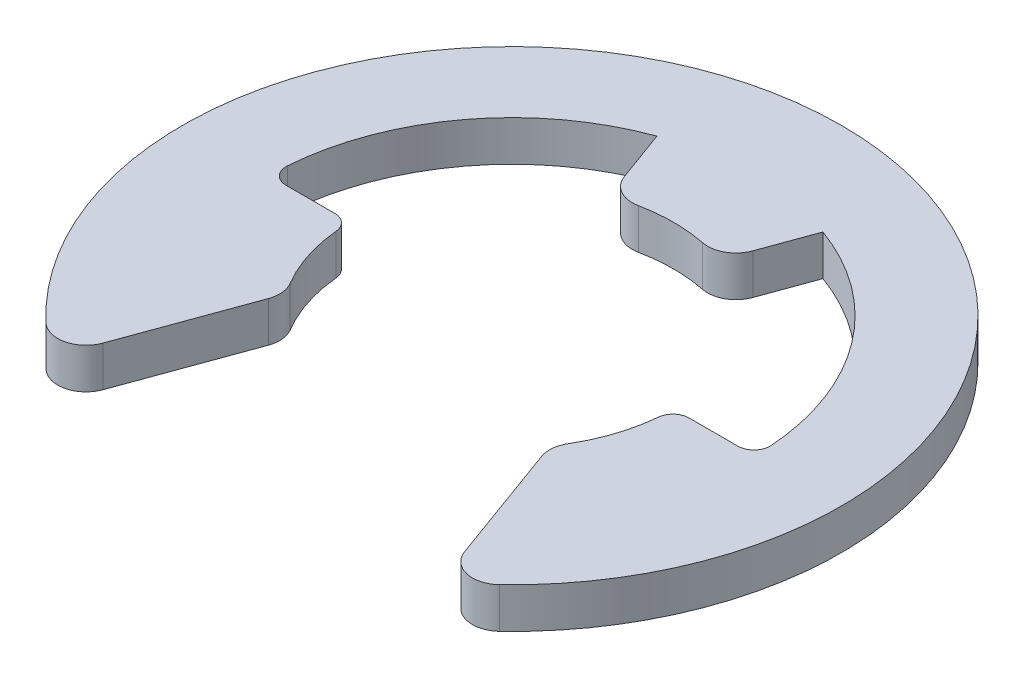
SolidWorks part; units mm, degrees
ref_plane "Front Plane" through (0, 0, 0) normal (0, 0, 1) x (1, 0, 0)
ref_plane "Top Plane" through (0, 0, 0) normal (0, 1, 0) x (1, 0, 0)
ref_plane "Right Plane" through (0, 0, 0) normal (1, 0, 0) x (0, 0, -1)
sketch "Sketch2" plane through (0, 0, 0) normal (0, 1, 0) x (1, 0, 0)
  line L0 (-4.8108, -6.5787) -> (-3.26, -2.3178)
  line L2 (3.26, -2.3178) -> (4.8108, -6.5787)
  line L4 (-4, 0) -> (-6, 0)
  line L5 (4, 0) -> (6, 0)
  line L6 (-2.0521, 5.6382) -> (-1.3681, 3.7588)
  line L8 (1.3681, 3.7588) -> (2.0521, 5.6382)
  arc A0 (4.8108, -6.5787) -> (-4.8108, -6.5787) centre (0, 0) ccw
  arc A1 (3.26, -2.3178) -> (4, 0) centre (0, 0) ccw
  arc A2 (6, 0) -> (2.0521, 5.6382) centre (0, 0) ccw
  arc A3 (-4, 0) -> (-3.26, -2.3178) centre (0, 0) ccw
  arc A4 (1.3681, 3.7588) -> (-1.3681, 3.7588) centre (0, 0) ccw
  arc A5 (-2.0521, 5.6382) -> (-6, 0) centre (0, 0) ccw
  point P15 (0, 0)
  point P16 (0, 4)
  dimension "D1" = 16.3
  dimension "D2" = 8
  dimension "D3" = 12
  dimension "D4" = 70
  dimension "D5" = 70
  dimension "D6" = 6.52
  dimension "D7" = 40
extrude "Boss-Extrude1" add sketch "Sketch2" along normal mid plane 1
fillet "Fillet1" radius 0.7 6 edges at (3.26, 0, 2.3178) (-3.26, 0, 2.3178) (1.3681, 0, -3.7588) (-1.3681, 0, -3.7588) (4.8108, 0, 6.5787) (-4.8108, 0, 6.5787)
fillet "Fillet2" radius 0.4 4 edges at (6, 0, 0) (4, 0, 0) (-6, 0, 0) (-4, 0, 0)
